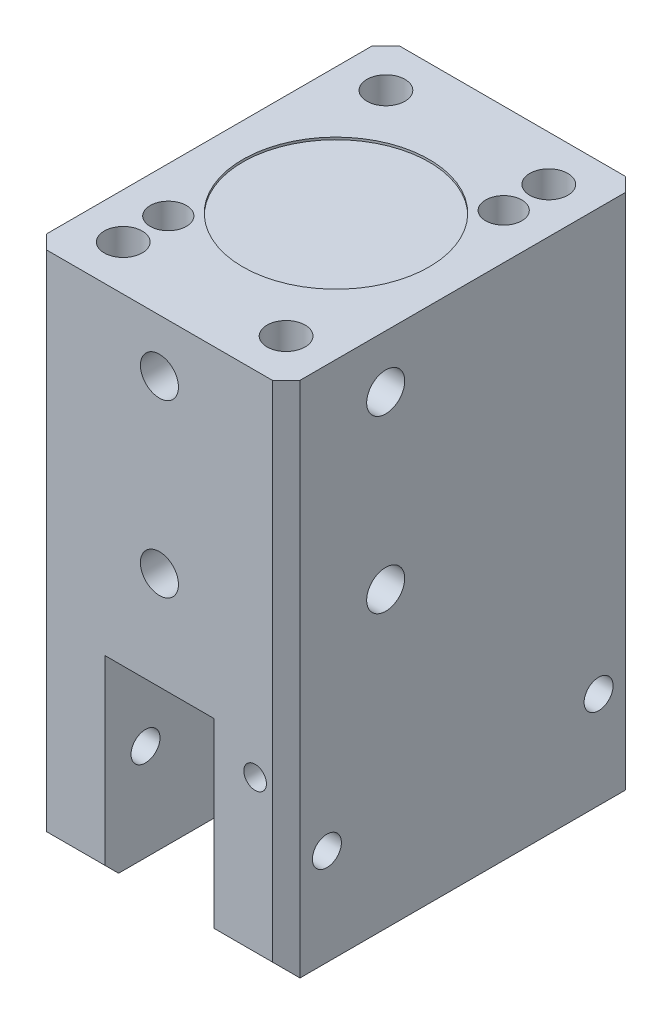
SolidWorks part; units mm, degrees
ref_plane "Front/Back" through (0, 0, 0) normal (0, 0, 1) x (1, 0, 0)
ref_plane "Top/Bottom" through (0, 0, 0) normal (0, 1, 0) x (1, 0, 0)
ref_plane "Right/Left" through (0, 0, 0) normal (1, 0, 0) x (0, 0, -1)
sketch "Sketch1" plane through (0, 0, 0) normal (0, 1, 0) x (1, 0, 0)
  line L0 (0, 0) -> (13.9954, 0) construction
  line L1 (-13.9954, 19.4945) -> (13.9954, 19.4945)
  line L2 (-13.9954, 19.4945) -> (-13.9954, -19.4945)
  line L3 (-13.9954, -19.4945) -> (13.9954, -19.4945)
  line L4 (13.9954, 19.4945) -> (13.9954, -19.4945)
  line L5 (0, 0) -> (0, 19.4945) construction
  dimension "D1" = 27.9908
  dimension "D2" = 38.989
extrude "Extrude1" add sketch "Sketch1" along normal mid plane 57.15
hole_wizard "M5 X .8 (Mount Holes )" positions "Sketch3" profile "Sketch2" tap size "M5x0.8" standard "ANSI Metric"
sketch "Sketch3" plane through (0, 28.575, 0) normal (0, 1, 0) x (-1, 0, 0)
  line L0 (0, 0) -> (0, 22.7765) construction
  line L1 (0, 0) -> (15.4693, 0) construction
  point P0 (-8.9916, -14.5034)
  point P1 (-8.9916, 14.5034)
  point P2 (8.9916, -14.5034)
  point P3 (8.9916, 14.5034)
  dimension "D1" = 29.0068
  dimension "D2" = 17.9832
sketch "Sketch2" plane through (8.9916, 28.575, -14.5034) normal (1, 0, 0) x (0, 0, 1)
  line L0 (0, 0) -> (0, 10.2534)
  line L1 (0, 10.2534) -> (2.1, 8.9916)
  line L2 (2.1, 8.9916) -> (2.1, 0)
  line L5 (2.1, 0) -> (0, 0)
  line L10 (0, 10.2534) -> (-2.1, 8.9916) construction
  line L11 (0, -6.35) -> (0, 107.95) construction
  dimension "Tap Drill Dia." = 4.2
  dimension "Tap Drill Depth" = 8.9916
  dimension "Drill Angle" = 118
sketch "Sketch5" plane through (0, 28.575, 0) normal (0, 1, 0) x (-1, 0, 0)
  circle A0 centre (0, 0) radius 10.287
  dimension "D1" = 20.574
extrude "Cut-Extrude1" cut sketch "Sketch5" against normal blind 0.254
sketch "Sketch6" plane through (0, 28.575, 0) normal (0, 1, 0) x (-1, 0, 0)
  line L0 (0, 0) -> (15.4141, 0) construction
  line L1 (0, 0) -> (0, 21.6735) construction
  circle A0 centre (8.9916, 9.525) radius 2
  circle A1 centre (-8.9916, -9.525) radius 2
  circle A2 centre (0, 0) radius 10.287 construction
  dimension "D1" = 4
  dimension "D2" = 9.525
  dimension "D3" = 9.525
extrude "(4MM Dowel - Slip Fit)" cut sketch "Sketch6" against normal blind 4.7625
hole_wizard "M5 X 0.8 (Air Ports)" positions "Sketch8" profile "Sketch7" tap size "M5x0.8" standard "Ansi Metric"
sketch "Sketch8" plane through (13.9954, 0, 0) normal (1, 0, 0) x (0, 0, -1)
  line L0 (0, 0) -> (22.2695, 0) construction
  line L1 (0, 0) -> (0, 31.0823) construction
  line L2 (0, 28.321) -> (0, 28.575) construction
  line L3 (-19.4945, 28.575) -> (19.4945, 28.575) construction
  point P0 (-8.509, 22.733)
  point P1 (-8.509, 3.8608)
  dimension "D1" = 8.509
  dimension "D2" = 5.842
  dimension "D3" = 18.8722
sketch "Sketch7" plane through (13.9954, 22.733, 8.509) normal (0, 1, 0) x (0, 0, -1)
  line L0 (0, 0) -> (0, 13.1618)
  line L1 (0, 13.1618) -> (2.1, 11.9)
  line L2 (2.1, 11.9) -> (2.1, 0)
  line L5 (2.1, 0) -> (0, 0)
  line L10 (0, 13.1618) -> (-2.1, 11.9) construction
  line L11 (0, -6.35) -> (0, 107.95) construction
  dimension "Tap Drill Dia." = 4.2
  dimension "Tap Drill Depth" = 11.9
  dimension "Drill Angle" = 118
hole_wizard "M5 X 0.8 Tapped Hole3" positions "Sketch11" profile "Sketch10" tap size "M5x0.8" standard "Ansi Metric"
sketch "Sketch11" plane through (0, 0, 19.4945) normal (0, 0, 1) x (1, 0, 0)
  line L0 (0, 0) -> (16.7813, 0) construction
  line L1 (0, 0) -> (0, 30.7657) construction
  line L2 (0, 28.321) -> (0, 28.575) construction
  line L3 (-13.9954, 28.575) -> (13.9954, 28.575) construction
  point P0 (0, 22.733)
  point P1 (0, 3.8608)
  dimension "D1" = 5.842
  dimension "D2" = 18.8722
sketch "Sketch10" plane through (0, 22.733, 19.4945) normal (1, 0, 0) x (0, -1, 0)
  line L0 (0, 0) -> (0, 8.8618)
  line L1 (0, 8.8618) -> (2.1, 7.6)
  line L2 (2.1, 7.6) -> (2.1, 0)
  line L5 (2.1, 0) -> (0, 0)
  line L10 (0, 8.8618) -> (-2.1, 7.6) construction
  line L11 (0, -6.35) -> (0, 107.95) construction
  dimension "Tap Drill Dia." = 4.2
  dimension "Tap Drill Depth" = 7.6
  dimension "Drill Angle" = 118
sketch "Sketch12" plane through (0, 0, 19.4945) normal (0, 0, 1) x (1, 0, 0)
  line L0 (0, 0) -> (17.0979, 0) construction
  line L1 (0, 0) -> (0, 30.6602) construction
  line L2 (0, 28.321) -> (0, 28.575) construction
  line L3 (-13.9954, -28.575) -> (13.9954, -28.575) construction
  line L4 (-6.0325, -28.575) -> (6.0325, -28.575)
  line L5 (-6.0325, -28.575) -> (-6.0325, -6.985)
  line L6 (-6.0325, -6.985) -> (6.0325, -6.985)
  line L7 (6.0325, -28.575) -> (6.0325, -6.985)
  line L8 (-13.9954, 28.575) -> (13.9954, 28.575) construction
  dimension "D1" = 35.56
  dimension "D2" = 12.065
extrude "Cut-Extrude3" cut sketch "Sketch12" against normal through all
hole_wizard "M5 X 0.8 (Mount Holes)" positions "Sketch14" profile "Sketch13" tap size "M5x0.8" standard "Ansi Metric"
sketch "Sketch14" plane through (-13.9954, 0, 0) normal (-1, 0, 0) x (0, 0, 1)
  line L0 (0, 0) -> (27.0189, 0) construction
  line L1 (0, 0) -> (0, 30.8713) construction
  line L2 (0, 28.321) -> (0, 28.575) construction
  line L3 (-19.4945, 28.575) -> (19.4945, 28.575) construction
  point P0 (14.5034, 5.08)
  point P1 (14.5034, 23.5712)
  point P2 (-14.5034, 23.5712)
  point P3 (-14.5034, 5.08)
  dimension "D1" = 5.0038
  dimension "D2" = 18.4912
  dimension "D3" = 29.0068
sketch "Sketch13" plane through (-13.9954, 5.08, 14.5034) normal (0, 1, 0) x (0, 0, 1)
  line L0 (0, 0) -> (0, 8.6118)
  line L1 (0, 8.6118) -> (2.1, 7.35)
  line L2 (2.1, 7.35) -> (2.1, 0)
  line L5 (2.1, 0) -> (0, 0)
  line L10 (0, 8.6118) -> (-2.1, 7.35) construction
  line L11 (0, -6.35) -> (0, 107.95) construction
  dimension "Tap Drill Dia." = 4.2
  dimension "Tap Drill Depth" = 7.35
  dimension "Drill Angle" = 118
sketch "Sketch15" plane through (-13.9954, 0, 0) normal (-1, 0, 0) x (0, 0, 1)
  line L0 (0, 0) -> (52.4604, 0) construction
  line L1 (0, 0) -> (0, 46.0176) construction
  line L2 (-19.4945, 28.575) -> (19.4945, 28.575) construction
  circle A0 centre (-14.5034, 14.3256) radius 1.5
  circle A1 centre (14.5034, 14.3256) radius 1.5
  dimension "D1" = 3
  dimension "D2" = 29.0068
  dimension "D3" = 14.2494
extrude "(3MM Dowel - Slip Fit)" cut sketch "Sketch15" against normal blind 5.08
sketch "Sketch16" plane through (-13.9954, 0, 0) normal (-1, 0, 0) x (0, 0, 1)
  line L0 (0, 0) -> (25.858, 0) construction
  line L1 (0, 0) -> (0, 30.3435) construction
  line L2 (0, 28.321) -> (0, 28.575) construction
  line L3 (-19.4945, -28.575) -> (19.4945, -28.575) construction
  circle A0 centre (-14.9987, -17.907) radius 1.6
  circle A1 centre (14.9987, -17.907) radius 1.6
  dimension "D1" = 3.2
  dimension "D2" = 10.668
  dimension "D3" = 29.9974
extrude "Cut-Extrude5" cut sketch "Sketch16" against normal through all
hole_wizard "M3x0.5 Tapped Hole1" positions "Sketch18" profile "Sketch17" tap size "M3x0.5" standard "Ansi Metric"
sketch "Sketch18" plane through (0, 0, 19.4945) normal (0, 0, 1) x (1, 0, 0)
  line L0 (0, 0) -> (16.9924, 0) construction
  line L1 (0, 0) -> (0, 30.6602) construction
  line L2 (0, 28.321) -> (0, 28.575) construction
  line L3 (-13.9954, 28.575) -> (13.9954, 28.575) construction
  line L4 (13.9954, 28.575) -> (13.9954, -28.575) construction
  point P0 (10.5664, -10.3378)
  dimension "D1" = 38.9128
  dimension "D2" = 3.429
sketch "Sketch17" plane through (10.5664, -10.3378, 19.4945) normal (1, 0, 0) x (0, -1, 0)
  line L0 (0, 0) -> (0, 8.7511)
  line L1 (0, 8.7511) -> (1.25, 8)
  line L2 (1.25, 8) -> (1.25, 0)
  line L5 (1.25, 0) -> (0, 0)
  line L10 (0, 8.7511) -> (-1.25, 8) construction
  line L11 (0, -6.35) -> (0, 107.95) construction
  dimension "Tap Drill Dia." = 2.5
  dimension "Tap Drill Depth" = 8
  dimension "Drill Angle" = 118
chamfer "Chamfer1" distance 1.524 angle 45 4 edges at (-13.9954, 0, -19.4945) (13.9954, 0, -19.4945) (-13.9954, 0, 19.4945) (13.9954, 0, 19.4945)
chamfer "Chamfer2" distance 1.524 angle 45 4 edges at (9.2519, -28.575, 19.4945) (9.252, -28.575, -19.4945) (-9.252, -28.575, 19.4945) (-9.2519, -28.575, -19.4945)
hole_wizard "M4x0.7 Tapped Hole1" positions "Sketch20" profile "Sketch19" tap size "M4x0.7" standard "Ansi Metric"
sketch "Sketch20" plane through (0, -28.575, 0) normal (0, -1, 0) x (1, 0, 0)
  line L0 (0, 0) -> (14.9875, 0) construction
  line L1 (0, 0) -> (0, 20.7328) construction
  line L2 (0, 11.8945) -> (0, 19.4945) construction
  point P0 (10.0203, 0)
  point P1 (-10.0203, 0)
  dimension "D1" = 20.0406
sketch "Sketch19" plane through (10.0203, -28.575, 0) normal (1, 0, 0) x (0, 0, -1)
  line L0 (0, 0) -> (0, 13.2914)
  line L1 (0, 13.2914) -> (1.65, 12.3)
  line L2 (1.65, 12.3) -> (1.65, 0)
  line L5 (1.65, 0) -> (0, 0)
  line L10 (0, 13.2914) -> (-1.65, 12.3) construction
  line L11 (0, -6.35) -> (0, 107.95) construction
  dimension "Tap Drill Dia." = 3.3
  dimension "Tap Drill Depth" = 12.3
  dimension "Drill Angle" = 118
hole_wizard "M3x0.5 Tapped Hole2" positions "Sketch22" profile "Sketch21" tap size "M3x0.5" standard "Ansi Metric"
sketch "Sketch22" plane through (0, -28.575, 0) normal (0, -1, 0) x (1, 0, 0)
  line L0 (13.9954, 17.9705) -> (13.9954, -17.9705) construction
  line L1 (12.4714, -19.4945) -> (6.0325, -19.4945) construction
  point P0 (10.5664, -14.7193)
  dimension "D1" = 3.429
  dimension "D2" = 4.7752
sketch "Sketch21" plane through (10.5664, -28.575, -14.7193) normal (1, 0, 0) x (0, 0, -1)
  line L0 (0, 0) -> (0, 7.5011)
  line L1 (0, 7.5011) -> (1.25, 6.75)
  line L2 (1.25, 6.75) -> (1.25, 0)
  line L5 (1.25, 0) -> (0, 0)
  line L10 (0, 7.5011) -> (-1.25, 6.75) construction
  line L11 (0, -6.35) -> (0, 107.95) construction
  dimension "Tap Drill Dia." = 2.5
  dimension "Tap Drill Depth" = 6.75
  dimension "Drill Angle" = 118
